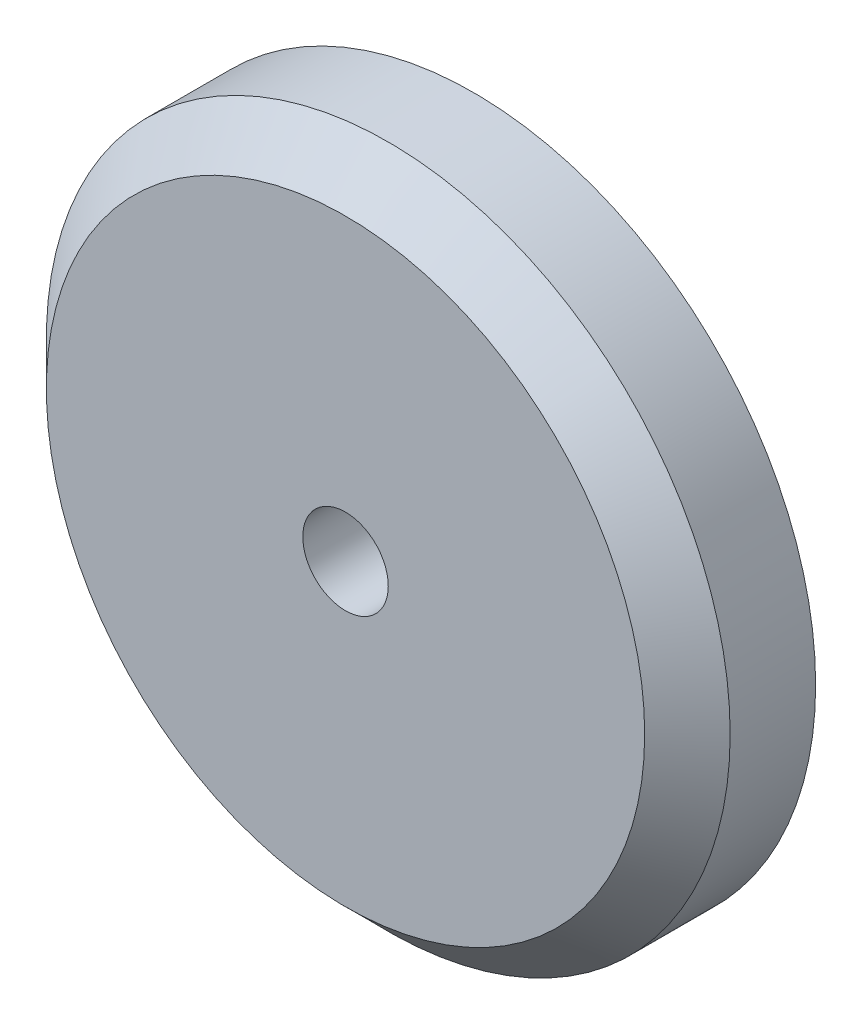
SolidWorks part; units mm, degrees
ref_plane "Plan de face" through (0, 0, 0) normal (0, 0, 1) x (1, 0, 0)
ref_plane "Plan de dessus" through (0, 0, 0) normal (0, 1, 0) x (1, 0, 0)
ref_plane "Plan de droite" through (0, 0, 0) normal (1, 0, 0) x (0, 0, -1)
sketch "Esquisse1" plane through (0, 0, 0) normal (0, 0, 1) x (1, 0, 0)
  circle A0 centre (0, 0) radius 5
  circle A1 centre (0, 0) radius 40
  dimension "D1" = 10
  dimension "D2" = 80
extrude "Boss.-Extru.1" add sketch "Esquisse1" along normal blind 15
chamfer "Chanfrein1" distance 5 angle 45 1 edges at (40, 0, 15)
